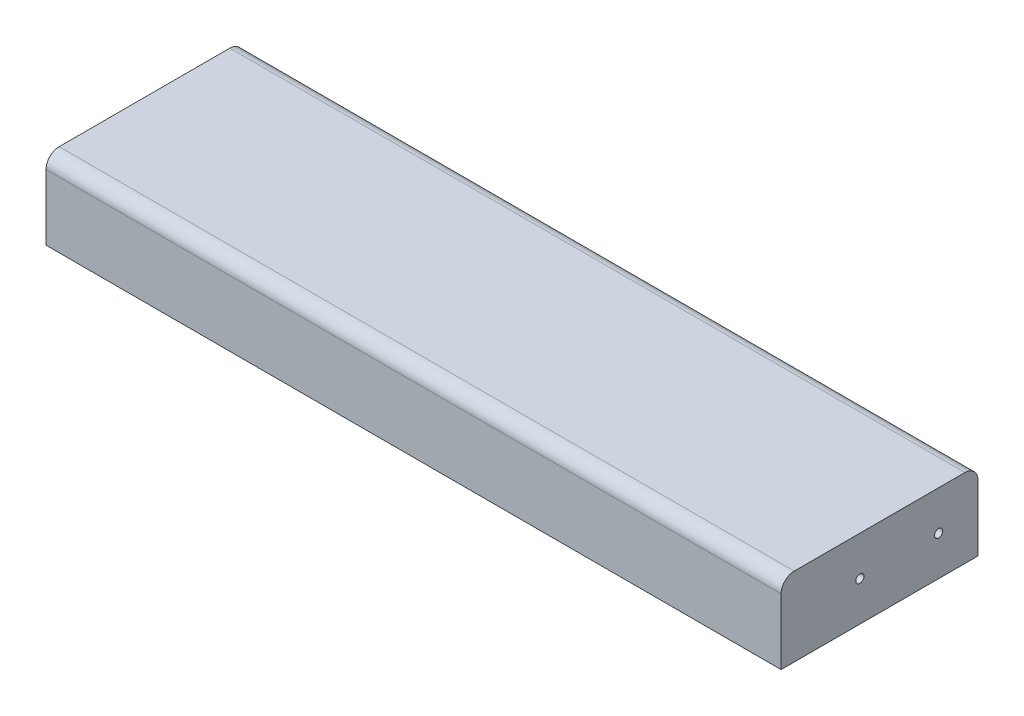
SolidWorks part; units mm, degrees
ref_plane "Piano frontale" through (0, 0, 0) normal (0, 0, 1) x (1, 0, 0)
ref_plane "Piano superiore" through (0, 0, 0) normal (0, 1, 0) x (1, 0, 0)
ref_plane "Piano destro" through (0, 0, 0) normal (1, 0, 0) x (0, 0, -1)
sketch "Schizzo1" plane through (0, 0, 0) normal (1, 0, 0) x (0, 0, -1)
  line L0 (-7.5, 15) -> (22.5, 15) construction
  line L1 (-32.5, 30) -> (32.5, 30)
  line L2 (-37.5, 25) -> (-37.5, 0)
  line L3 (7.5, 0) -> (7.5, 15) construction
  line L4 (37.5, 25) -> (37.5, 0)
  line L5 (-37.5, 0) -> (37.5, 0)
  circle A0 centre (-7.5, 15) radius 1.55
  arc A1 (-32.5, 30) -> (-37.5, 25) centre (-32.5, 25) ccw
  arc A2 (32.5, 30) -> (37.5, 25) centre (32.5, 25) cw
  circle A3 centre (22.5, 15) radius 1.55
  point P1 (0, 0)
  dimension "D1" = 30
  dimension "D3" = 5
  dimension "D4" = 3.1
  dimension "D2" = 75
  dimension "D5" = 15
  dimension "D6" = 30
  dimension "D7" = 30
extrude "Estrusione-Estrusione1" add sketch "Schizzo1" along normal blind 280
shell "Svuota1" thickness 2
sketch "Schizzo2" plane through (0, 30, 0) normal (0, 1, 0) x (1, 0, 0)
  line L0 (140, -27.5) -> (140, 37.5) construction
  line L1 (30, -29.5) -> (250, -29.5)
  line L2 (30, -29.5) -> (30, -25.5)
  line L3 (30, -25.5) -> (250, -25.5)
  line L4 (250, -29.5) -> (250, -25.5)
  line L5 (30, -29.5) -> (250, -25.5) construction
  line L6 (30, -25.5) -> (250, -29.5) construction
  line L7 (280, 37.5) -> (0, 37.5) construction
  point P0 (140, -27.5)
  dimension "D1" = 4
  dimension "D2" = 220
  dimension "D3" = 65
